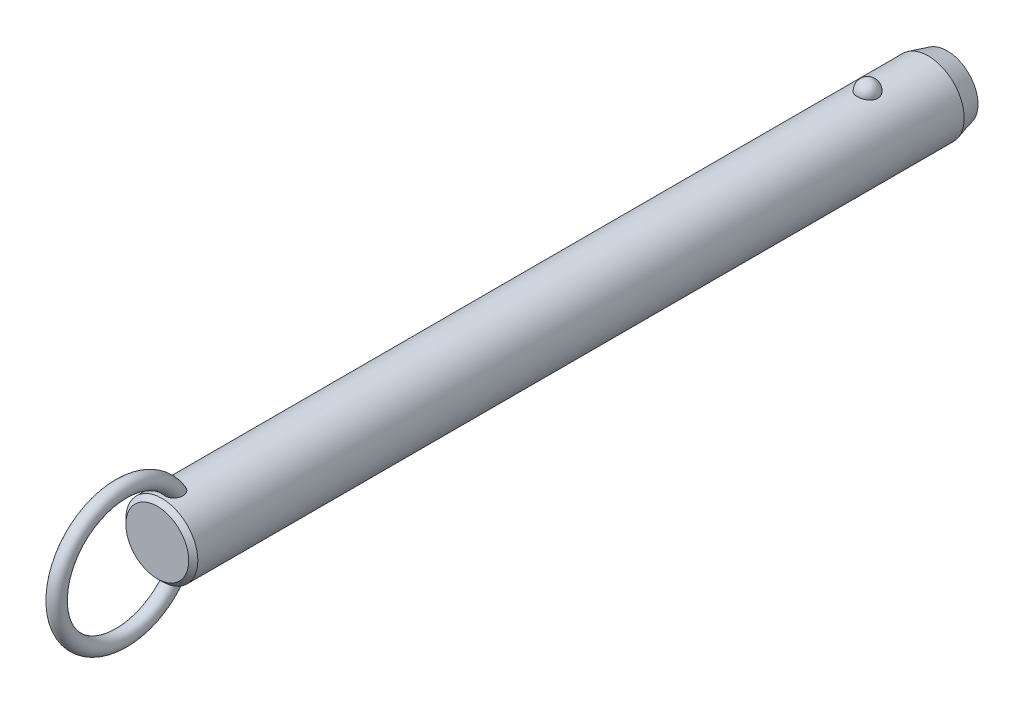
SolidWorks part; units mm, degrees
ref_plane "Front Plane" through (0, 0, 0) normal (0, 0, 1) x (1, 0, 0)
ref_plane "Top Plane" through (0, 0, 0) normal (0, 1, 0) x (1, 0, 0)
ref_plane "Right Plane" through (0, 0, 0) normal (1, 0, 0) x (0, 0, -1)
sketch "Sketch2" plane through (0, 0, 0) normal (0, 0, 1) x (1, 0, 0)
  circle A0 centre (0, 0) radius 9.5
  point P3 (0, 9.5)
  dimension "D1" = 19
extrude "Boss-Extrude1" add sketch "Sketch2" along normal blind 175.3
sketch "Sketch3" plane through (0, 0, 0) normal (0, 0, -1) x (-1, 0, 0)
  circle A0 centre (0, 0) radius 9.5
  dimension "D1" = 19
extrude "Boss-Extrude2" add sketch "Sketch3" along normal blind 23.7
chamfer "Chamfer1" distance 5 angle 15 1 edges at (-9.5, 0, -23.7)
sketch "Sketch12" plane through (0, 0, 0) normal (1, 0, 0) x (0, 0, -1)
  line L0 (-175.3, 9.5) -> (-175.3, -9.5) construction
  point P0 (-175.3, 0)
sketch "Sketch13" plane through (0, 0, 0) normal (1, 0, 0) x (0, 0, -1)
  circle A0 centre (-194.35, 0) radius 19.05
  point P2 (-175.3, 0)
  dimension "D1" = 38.1
sketch "Sketch14" plane through (0, 0, 0) normal (0, 1, 0) x (1, 0, 0)
  circle A0 centre (0, -177.3) radius 2
  point P2 (0, -175.3)
  dimension "D1" = 4
sweep "Sweep1" add profiles "Sketch14" path "Sketch13"
sketch "Sketch15" plane through (0, 0, 175.3) normal (0, 0, 1) x (1, 0, 0)
  circle A0 centre (0, 0) radius 9.5
  dimension "D1" = 19
extrude "Boss-Extrude3" add sketch "Sketch15" along normal blind 9.52
chamfer "Chamfer2" distance 1.2 angle 45 1 edges at (9.5, 0, 184.82)
sketch "Sketch18" plane through (0, 0, 0) normal (1, 0, 0) x (0, 0, -1)
  line L0 (18.7, 9.5) -> (-177.8378, 9.5) construction
  line L1 (2.7, 12.2) -> (2.7, 6.8)
  line L2 (-177.8378, -9.5) -> (18.7, -9.5) construction
  arc A0 (2.7, 12.2) -> (2.7, 6.8) centre (2.7, 9.5) ccw
  point P4 (0, 9.5)
  dimension "D1" = 21.7
revolve "Revolve1" add sketch "Sketch18" angle 360 about L1
